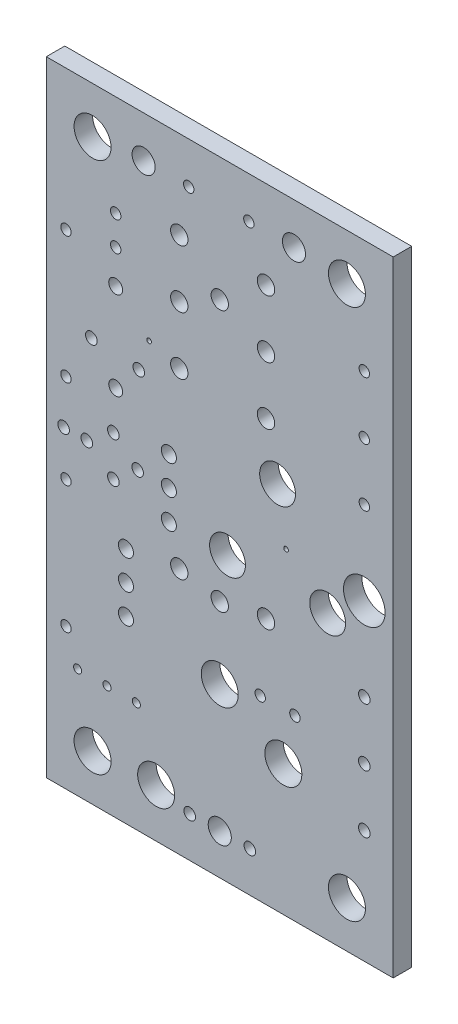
SolidWorks part; units mm, degrees
ref_plane "Plan de face" through (0, 0, 0) normal (0, 0, 1) x (1, 0, 0)
ref_plane "Plan de dessus" through (0, 0, 0) normal (0, 1, 0) x (1, 0, 0)
ref_plane "Plan de droite" through (0, 0, 0) normal (1, 0, 0) x (0, 0, -1)
sketch "Model" plane through (0, 0, 0) normal (0, 0, 1) x (1, 0, 0)
  line L1 (0, 54) -> (30, 54)
  line L2 (0, 54) -> (0, 0)
  line L3 (0, 0) -> (30, 0)
  line L4 (30, 54) -> (30, 0)
  line L278 (-4.4605, 0) -> (53.8292, 0) construction
  line L279 (0, -5.5056) -> (0, 76.3648) construction
  line L280 (30, -5.5056) -> (30, 76.3648) construction
  line L281 (-4.4605, 54) -> (53.8292, 54) construction
  line L282 (39.5217, 27) -> (47.7353, 27) construction
  line L283 (15, 64.7069) -> (15, 73.1854) construction
  line L284 (-4.6426, 50) -> (5.2388, 50) construction
  line L285 (4, 58.758) -> (4, 46.99) construction
  circle A0 centre (5.7988, 28.7503) radius 0.5
  circle A1 centre (6.8898, 18.0492) radius 0.65
  circle A2 centre (10.6007, 27.0002) radius 0.65
  circle A3 centre (1.7005, 30.8991) radius 0.45
  circle A4 centre (19.0005, 41.4007) radius 0.75
  circle A5 centre (5.7988, 25.2503) radius 0.5
  circle A6 centre (7.8988, 27.0003) radius 0.5
  circle A7 centre (3.4988, 27.0003) radius 0.5
  circle A8 centre (1.4988, 27.0003) radius 0.5
  circle A9 centre (10.6007, 29.5402) radius 0.65
  circle A10 centre (15, 20.6997) radius 0.75
  circle A11 centre (15, 43.2997) radius 0.75
  circle A12 centre (19.0005, 46.4007) radius 0.75
  circle A13 centre (11.5005, 36.4007) radius 0.75
  circle A14 centre (11.5005, 41.4007) radius 0.75
  circle A15 centre (11.5005, 46.4007) radius 0.75
  circle A16 centre (27.4993, 39.2011) radius 0.45
  circle A17 centre (27.4993, 34.2011) radius 0.45
  circle A18 centre (27.5006, 27.0006) radius 1.8
  circle A19 centre (5.9995, 39.8094) radius 0.6
  circle A20 centre (24.3306, 24.5006) radius 1.55
  circle A21 centre (27.5006, 19.8006) radius 0.5
  circle A22 centre (7.7889, 9.4996) radius 0.35
  circle A23 centre (2.7089, 9.4996) radius 0.35
  circle A24 centre (15.6706, 24.5006) radius 1.55
  circle A25 centre (27.5006, 9.7993) radius 0.5
  circle A26 centre (6.8898, 15.5092) radius 0.65
  circle A27 centre (20.0006, 32.0006) radius 1.55
  circle A28 centre (12.3171, 50.4165) radius 0.45
  circle A29 centre (21.4171, 50.4165) radius 1
  circle A30 centre (8.4171, 50.4165) radius 1
  circle A33 centre (1.7005, 12.1996) radius 0.45
  circle A34 centre (20.4991, 11.303) radius 1.6
  circle A35 centre (14.9987, 14.5021) radius 1.6
  circle A36 centre (9.4996, 4.2024) radius 1.6
  circle A45 centre (6.8898, 20.5892) radius 0.65
  circle A55 centre (10.6007, 24.4602) radius 0.65
  circle A61 centre (1.7005, 23.2004) radius 0.45
  circle A62 centre (27.5006, 14.8006) radius 0.5
  circle A79 centre (20.7366, 27.4828) radius 0.2
  circle A80 centre (8.8951, 37.1653) radius 0.2
  circle A94 centre (6.0033, 45.2679) radius 0.45
  circle A99 centre (1.7005, 41.8998) radius 0.45
  circle A100 centre (19.0005, 36.4007) radius 0.75
  circle A111 centre (27.4993, 44.2011) radius 0.45
  circle A112 centre (5.9995, 32.1894) radius 0.6
  circle A120 centre (19.0005, 21.3995) radius 0.75
  circle A151 centre (5.2489, 9.4996) radius 0.35
  circle A152 centre (21.4998, 15.4) radius 0.45
  circle A154 centre (6.0033, 42.7279) radius 0.45
  circle A169 centre (17.5171, 50.4165) radius 0.45
  circle A172 centre (3.8976, 34.8818) radius 0.5
  circle A177 centre (7.9959, 34.5542) radius 0.5
  circle A180 centre (18.5001, 15.4) radius 0.45
  circle A191 centre (11.4998, 21.3995) radius 0.75
  circle A192 centre (4, 50) radius 1.6
  circle A193 centre (26, 50) radius 1.6
  circle A194 centre (26, 4) radius 1.6
  circle A195 centre (4, 4) radius 1.6
  circle A196 centre (12.4003, 3.5001) radius 0.5
  circle A197 centre (15.0003, 3.5001) radius 1
  circle A198 centre (17.6003, 3.5001) radius 0.5
  circle A199 centre (5.7988, 27.0003) radius 0.5
  circle A200 centre (20.0006, 24.5006) radius 1.55
  dimension "D7" = 2
  dimension "D8" = 2
  dimension "D10" = 2
  dimension "D11" = 3
  dimension "D12" = 3
  dimension "D13" = 2
  dimension "D15" = 3
  dimension "D17" = 3
  dimension "D18" = 3
  dimension "D19" = 2
  dimension "D20" = 2
  dimension "D1" = 15
  dimension "D2" = 30
  dimension "D3" = 54
  dimension "D4" = 27
  dimension "D5" = 4
  dimension "D6" = 4
  dimension "D9" = 2
  dimension "D14" = 2
  dimension "D16" = 2
extrude "Boss.-Extru.1" add sketch "Model" along normal blind 1.6
